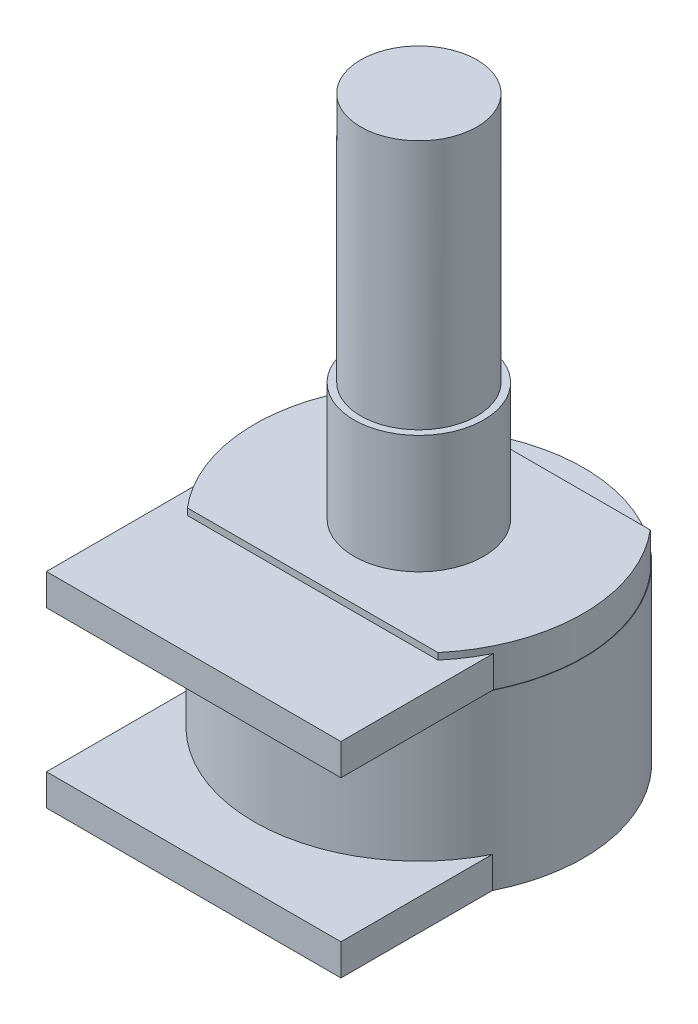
SolidWorks part; units mm, degrees
ref_plane "Front Plane" through (0, 0, 0) normal (0, 0, 1) x (1, 0, 0)
ref_plane "Top Plane" through (0, 0, 0) normal (0, 1, 0) x (1, 0, 0)
ref_plane "Right Plane" through (0, 0, 0) normal (1, 0, 0) x (0, 0, -1)
sketch "Sketch1" plane through (0, 0, 0) normal (0, 1, 0) x (1, 0, 0)
  circle A0 centre (0, 0) radius 3
  dimension "D1" = 6
extrude "Boss-Extrude1" add sketch "Sketch1" along normal blind 12.92
sketch "Sketch2" plane through (0, 0, 0) normal (0, -1, 0) x (1, 0, 0)
  circle A0 centre (0, 0) radius 3.35
  dimension "D1" = 6.7
extrude "Boss-Extrude2" add sketch "Sketch2" along normal blind 6.1
sketch "Sketch3" plane through (0, -6.1, 0) normal (0, -1, 0) x (1, 0, 0)
  circle A0 centre (0, 0) radius 8.475
  dimension "D1" = 16.95
extrude "Boss-Extrude3" add sketch "Sketch3" along normal blind 1.96
sketch "Sketch4" plane through (0, -8.06, 0) normal (0, -1, 0) x (1, 0, 0)
  line L1 (-11.8716, -5.48) -> (11.8716, -5.48)
  line L2 (-11.8716, -5.48) -> (-11.8716, 5.48)
  line L3 (-11.8716, 5.48) -> (11.8716, 5.48)
  line L4 (11.8716, -5.48) -> (11.8716, 5.48)
  line L5 (-11.8716, -5.48) -> (11.8716, 5.48) construction
  line L6 (-11.8716, 5.48) -> (11.8716, -5.48) construction
  point P0 (0, 0)
  dimension "D1" = 10.96
extrude "Cut-Extrude1" cut sketch "Sketch4" against normal blind 1.96 flip side to cut
sketch "Sketch5" plane through (0, -8.06, 0) normal (0, -1, 0) x (1, 0, 0)
  circle A0 centre (0, 0) radius 8.5
  dimension "D1" = 17
extrude "Boss-Extrude4" add sketch "Sketch5" along normal blind 8.95
sketch "Sketch6" plane through (0, -8.06, 0) normal (0, 1, 0) x (1, 0, 0)
  line L0 (0, 0) -> (0, -12.0175) construction
  line L1 (-7.6, -0.2233) -> (7.6, -0.2233)
  line L2 (-7.6, -0.2233) -> (-7.6, -11.62)
  line L3 (-7.6, -11.62) -> (7.6, -11.62)
  line L4 (7.6, -0.2233) -> (7.6, -11.62)
  line L5 (-7.6, -0.2233) -> (7.6, -11.62) construction
  line L6 (-7.6, -11.62) -> (7.6, -0.2233) construction
  line L7 (0, 8.5) -> (11.0751, 8.5) construction
  circle A0 centre (0, 0) radius 8.5 construction
  point P0 (0, -5.9217)
  dimension "D1" = 15.2
  dimension "D2" = 20.12
extrude "Boss-Extrude5" add sketch "Sketch6" along normal blind 1.62
ref_plane "Plane1" through (0, -11.725, 0) normal (0, 1, 0) x (1, 0, 0)
mirror "Mirror1" about plane through (0, -11.725, 0) normal (0, 1, 0) of "Boss-Extrude5"
